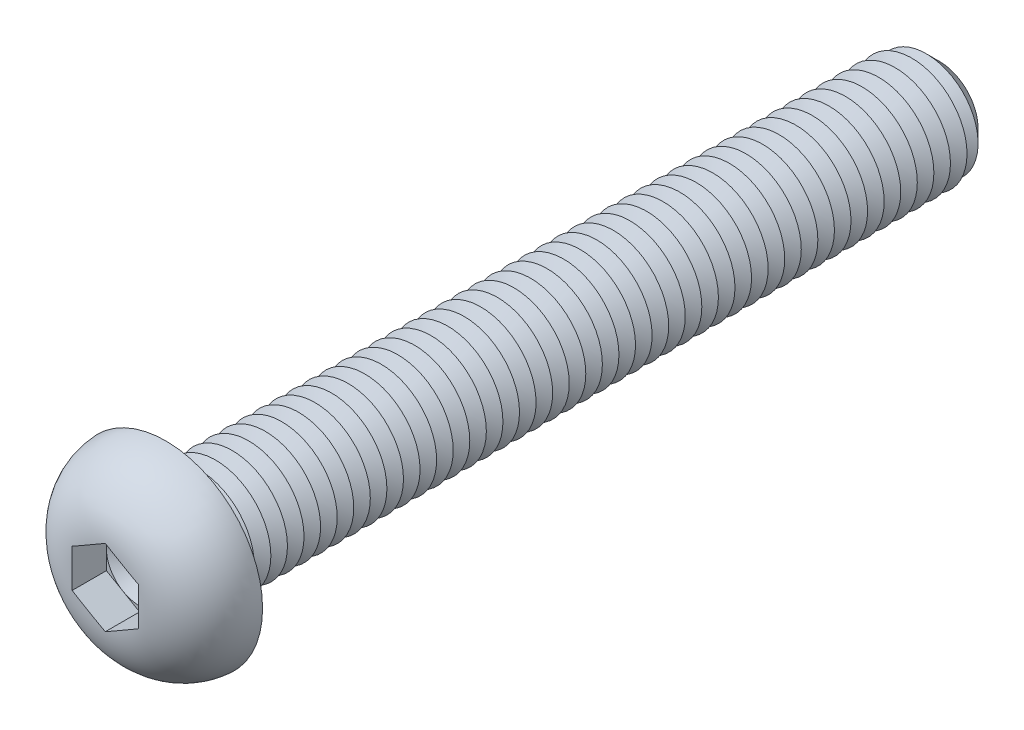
SolidWorks part; units mm, degrees
ref_plane "Front Plane" through (0, 0, 0) normal (0, 0, 1) x (1, 0, 0)
ref_plane "Top Plane" through (0, 0, 0) normal (0, 1, 0) x (1, 0, 0)
ref_plane "Right Plane" through (0, 0, 0) normal (1, 0, 0) x (0, 0, -1)
sketch "Sketch1" plane through (0, 0, 0) normal (1, 0, 0) x (0, 0, -1)
  line L0 (-47.9342, 0) -> (60.3146, 0) construction
sketch "Sketch2" plane through (0, 0, 0) normal (1, 0, 0) x (0, 0, -1)
  line L0 (0, 0) -> (-5.5, 0)
  line L1 (-47.9342, 0) -> (60.3146, 0) construction
  line L2 (-5.5, 0) -> (-5.5, 2.9578)
  line L3 (0, 8.75) -> (0, 0)
  arc A0 (-5.5, 2.9578) -> (0, 8.75) centre (0.3, 2.9578) cw
  dimension "D1" = 5.8
  dimension "D2" = 5.5
  dimension "D3" = 8.75
revolve "Revolve1" add sketch "Sketch2" angle 360 about L0
sketch "Sketch3" plane through (0, 0, 5.5) normal (0, 0, 1) x (1, 0, 0)
  line L1 (0, 3.4641) -> (-3, 1.7321)
  line L2 (-3, 1.7321) -> (-3, -1.7321)
  line L3 (-3, -1.7321) -> (0, -3.4641)
  line L4 (0, -3.4641) -> (3, -1.7321)
  line L5 (3, -1.7321) -> (3, 1.7321)
  line L6 (3, 1.7321) -> (0, 3.4641)
  circle A0 centre (0, 0) radius 3 construction
  dimension "D1" = 6
extrude "Cut-Extrude1" cut sketch "Sketch3" against normal blind 3.12
sketch "Sketch4" plane through (0, 0, 0) normal (0, 0, -1) x (-1, 0, 0)
  circle A0 centre (0, 0) radius 5
  dimension "D1" = 10
extrude "Boss-Extrude1" add sketch "Sketch4" along normal blind 70
chamfer "Chamfer1" distance 1.5 angle 45 1 edges at (-5, 0, -70)
sketch "Sketch5" plane through (0, 0, 0) normal (1, 0, 0) x (0, 0, -1)
  line L0 (1.5, 5) -> (3, 5)
  line L1 (68.5, 5) -> (0, 5) construction
  line L2 (3, 5) -> (2.25, 3.701)
  line L3 (2.25, 3.701) -> (1.5, 5)
  line L4 (0, -8.75) -> (0, 8.75) construction
  line L5 (68.5, 5) -> (0, 5) construction
  dimension "D1" = 1.5
  dimension "D2" = 1.5
revolve "Cut-Revolve1" cut sketch "Sketch5" angle 360 about L0
pattern_linear "LPattern1" count 45 spacing 1.5 along (0, 0, -1) of "Cut-Revolve1"
fillet "Fillet2" radius 0.6 1 edges at (5, 0, 0)
sketch "Sketch6" plane through (0, 0, 2.38) normal (0, 0, 1) x (1, 0, 0)
  line L0 (0, -3.4641) -> (3, -1.7321) construction
  circle A0 centre (0, 0) radius 3
extrude "Cut-Extrude2" cut sketch "Sketch6" against normal through all draft 60
